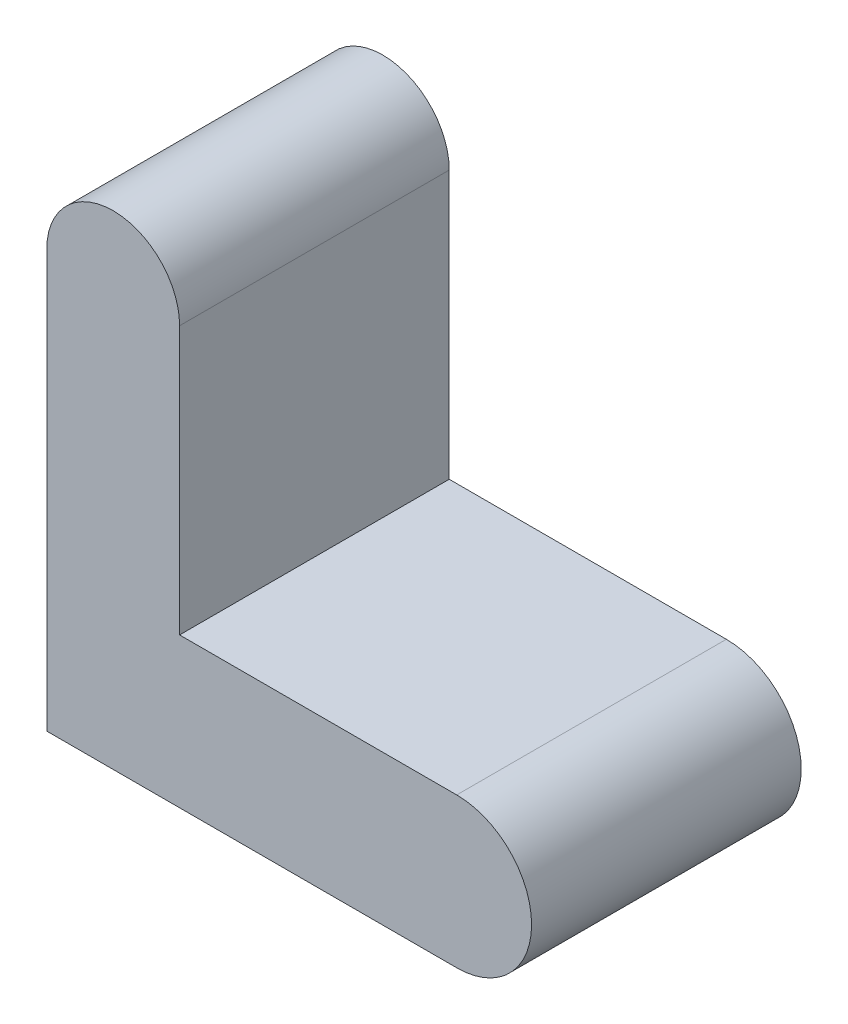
SolidWorks part; units mm, degrees
ref_plane "FrontPlane" through (0, 0, 0) normal (0, 0, 1) x (1, 0, 0)
ref_plane "Top" through (0, 0, 0) normal (0, 1, 0) x (1, 0, 0)
ref_plane "Right" through (0, 0, 0) normal (1, 0, 0) x (0, 0, -1)
ref_plane "Plane1" through (0, 0, 75.1895) normal (0, 0, 1) x (1, 0, 0)
sketch "Sketch1" plane through (0, 0, 0) normal (0, 0, 1) x (1, 0, 0)
  line L0 (-61.3036, -19.4349) -> (45.1263, -19.4349)
  line L1 (45.1263, 19.4349) -> (-26.8203, 19.4349)
  line L2 (-26.8203, 19.4349) -> (-26.8203, 88.9544)
  line L3 (-61.3036, 88.9544) -> (-61.3036, -19.4349)
  arc A0 (45.1263, -19.4349) -> (45.1263, 19.4349) centre (45.1263, 0) ccw
  arc A1 (-26.8203, 88.9544) -> (-61.3036, 88.9544) centre (-44.062, 88.9544) ccw
extrude "Boss-Extrude1" add sketch "Sketch1" along normal blind 70 from offset 30
